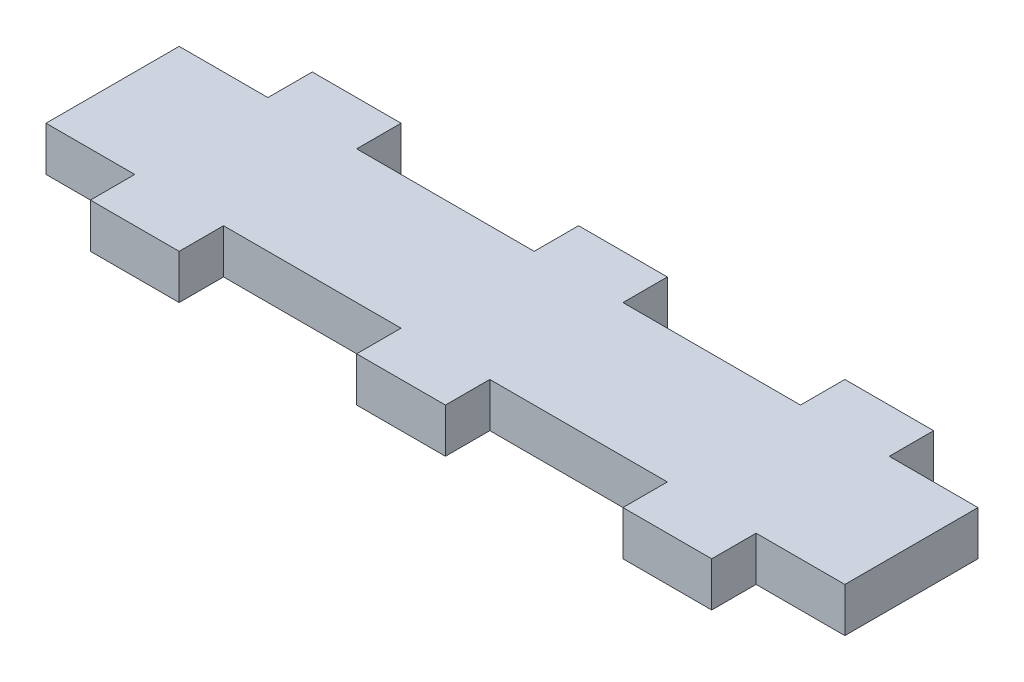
SolidWorks part; units mm, degrees
ref_plane "Front Plane" through (0, 0, 0) normal (0, 0, 1) x (1, 0, 0)
ref_plane "Top Plane" through (0, 0, 0) normal (0, 1, 0) x (1, 0, 0)
ref_plane "Right Plane" through (0, 0, 0) normal (1, 0, 0) x (0, 0, -1)
sketch "Sketch1" plane through (0, 0, 0) normal (0, 1, 0) x (1, 0, 0)
  line L1 (-57.15, 9.525) -> (57.15, 9.525)
  line L2 (-57.15, 9.525) -> (-57.15, -9.525)
  line L3 (-57.15, -9.525) -> (57.15, -9.525)
  line L4 (57.15, 9.525) -> (57.15, -9.525)
  line L5 (-57.15, 9.525) -> (57.15, -9.525) construction
  line L6 (-57.15, -9.525) -> (57.15, 9.525) construction
  point P0 (0, 0)
  dimension "D1" = 19.05
  dimension "D2" = 114.3
extrude "Boss-Extrude1" add sketch "Sketch1" along normal mid plane 6.35
sketch "Sketch2" plane through (0, 3.175, 0) normal (0, 1, 0) x (1, 0, 0)
  line L0 (57.15, 9.525) -> (-57.15, 9.525) construction
  line L1 (-44.45, 9.525) -> (-31.75, 9.525)
  line L2 (-44.45, 9.525) -> (-44.45, 15.875)
  line L3 (-44.45, 15.875) -> (-31.75, 15.875)
  line L4 (-31.75, 9.525) -> (-31.75, 15.875)
  line L5 (-31.75, 9.525) -> (31.75, 9.525) construction
  line L6 (31.75, 9.525) -> (44.45, 9.525)
  line L7 (31.75, 9.525) -> (31.75, 15.875)
  line L8 (31.75, 15.875) -> (44.45, 15.875)
  line L9 (44.45, 9.525) -> (44.45, 15.875)
  line L10 (0, 9.525) -> (0, 0) construction
  line L12 (-6.35, 9.525) -> (6.35, 9.525)
  line L13 (-6.35, 9.525) -> (-6.35, 15.875)
  line L14 (-6.35, 15.875) -> (6.35, 15.875)
  line L15 (6.35, 9.525) -> (6.35, 15.875)
  dimension "D1" = 12.7
  dimension "D2" = 38.1
  dimension "D3" = 6.35
extrude "Boss-Extrude2" add sketch "Sketch2" against normal up to surface (6.35 mm away)
mirror "Mirror1" about plane through (0, 0, 0) normal (0, 0, 1) of "Boss-Extrude2"
sketch "Sketch3" plane through (0, 3.175, 0) normal (0, 1, 0) x (1, 0, 0)
  line L56 (57.2516, -9.6266) -> (57.2516, 9.6266)
  line L57 (57.2516, 9.6266) -> (44.5516, 9.6266)
  line L58 (44.5516, 9.6266) -> (44.5516, 15.9766)
  line L59 (44.5516, 15.9766) -> (31.6484, 15.9766)
  line L60 (31.6484, 15.9766) -> (31.6484, 9.6266)
  line L61 (31.6484, 9.6266) -> (6.4516, 9.6266)
  line L62 (6.4516, 9.6266) -> (6.4516, 15.9766)
  line L63 (6.4516, 15.9766) -> (-6.4516, 15.9766)
  line L64 (-6.4516, 15.9766) -> (-6.4516, 9.6266)
  line L65 (-6.4516, 9.6266) -> (-31.6484, 9.6266)
  line L66 (-31.6484, 9.6266) -> (-31.6484, 15.9766)
  line L67 (-31.6484, 15.9766) -> (-44.5516, 15.9766)
  line L68 (-44.5516, 15.9766) -> (-44.5516, 9.6266)
  line L69 (-44.5516, 9.6266) -> (-57.2516, 9.6266)
  line L70 (-57.2516, 9.6266) -> (-57.2516, -9.6266)
  line L71 (-57.2516, -9.6266) -> (-44.5516, -9.6266)
  line L72 (-44.5516, -9.6266) -> (-44.5516, -15.9766)
  line L73 (-44.5516, -15.9766) -> (-31.6484, -15.9766)
  line L74 (-31.6484, -15.9766) -> (-31.6484, -9.6266)
  line L75 (-31.6484, -9.6266) -> (-6.4516, -9.6266)
  line L76 (-6.4516, -9.6266) -> (-6.4516, -15.9766)
  line L77 (-6.4516, -15.9766) -> (6.4516, -15.9766)
  line L78 (6.4516, -15.9766) -> (6.4516, -9.6266)
  line L79 (6.4516, -9.6266) -> (31.6484, -9.6266)
  line L80 (31.6484, -9.6266) -> (31.6484, -15.9766)
  line L81 (31.6484, -15.9766) -> (44.5516, -15.9766)
  line L82 (44.5516, -15.9766) -> (44.5516, -9.6266)
  line L83 (44.5516, -9.6266) -> (57.2516, -9.6266)
  line L84 (57.2516, -9.6266) -> (57.2516, 9.6266)
  line L85 (57.2516, 9.6266) -> (44.5516, 9.6266)
  line L86 (44.5516, 9.6266) -> (44.5516, 15.9766)
  line L87 (44.5516, 15.9766) -> (31.6484, 15.9766)
  line L88 (31.6484, 15.9766) -> (31.6484, 9.6266)
  line L89 (31.6484, 9.6266) -> (6.4516, 9.6266)
  line L90 (6.4516, 9.6266) -> (6.4516, 15.9766)
  line L91 (6.4516, 15.9766) -> (-6.4516, 15.9766)
  line L92 (-6.4516, 15.9766) -> (-6.4516, 9.6266)
  line L93 (-6.4516, 9.6266) -> (-31.6484, 9.6266)
  line L94 (-31.6484, 9.6266) -> (-31.6484, 15.9766)
  line L95 (-31.6484, 15.9766) -> (-44.5516, 15.9766)
  line L96 (-44.5516, 15.9766) -> (-44.5516, 9.6266)
  line L97 (-44.5516, 9.6266) -> (-57.2516, 9.6266)
  line L98 (-57.2516, 9.6266) -> (-57.2516, -9.6266)
  line L99 (-57.2516, -9.6266) -> (-44.5516, -9.6266)
  line L100 (-44.5516, -9.6266) -> (-44.5516, -15.9766)
  line L101 (-44.5516, -15.9766) -> (-31.6484, -15.9766)
  line L102 (-31.6484, -15.9766) -> (-31.6484, -9.6266)
  line L103 (-31.6484, -9.6266) -> (-6.4516, -9.6266)
  line L104 (-6.4516, -9.6266) -> (-6.4516, -15.9766)
  line L105 (-6.4516, -15.9766) -> (6.4516, -15.9766)
  line L106 (6.4516, -15.9766) -> (6.4516, -9.6266)
  line L107 (6.4516, -9.6266) -> (31.6484, -9.6266)
  line L108 (31.6484, -9.6266) -> (31.6484, -15.9766)
  line L109 (31.6484, -15.9766) -> (44.5516, -15.9766)
  line L110 (44.5516, -15.9766) -> (44.5516, -9.6266)
  line L111 (44.5516, -9.6266) -> (57.2516, -9.6266)
  dimension "D1" = 0.1016
